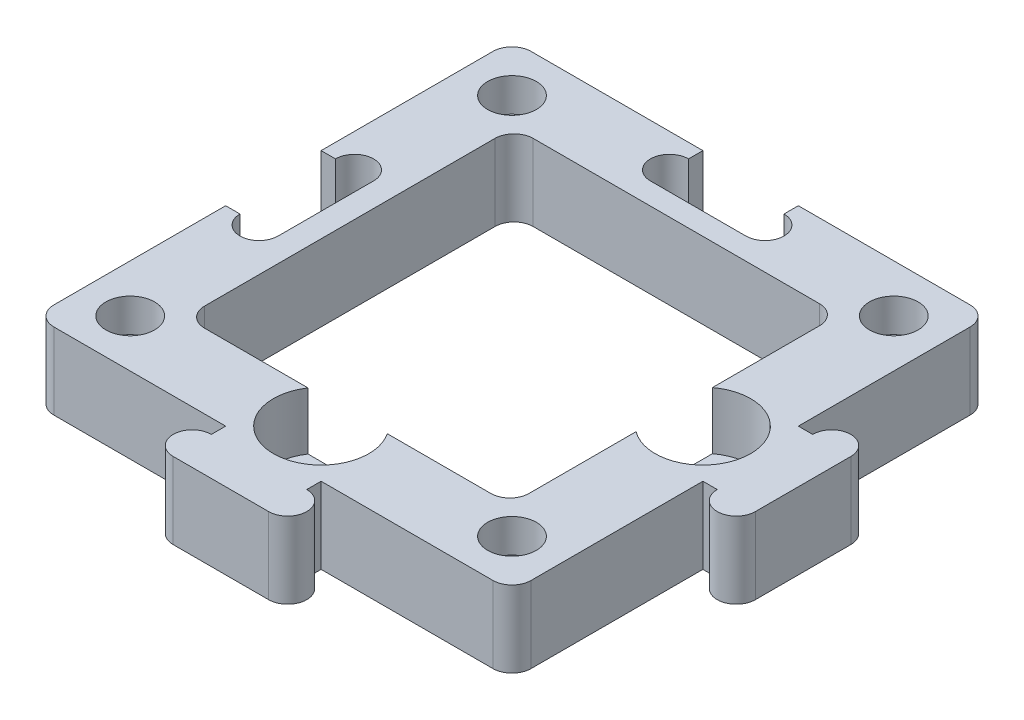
SolidWorks part; units mm, degrees
ref_plane "Front Plane" through (0, 0, 0) normal (0, 0, 1) x (1, 0, 0)
ref_plane "Top Plane" through (0, 0, 0) normal (0, 1, 0) x (1, 0, 0)
ref_plane "Right Plane" through (0, 0, 0) normal (1, 0, 0) x (0, 0, -1)
sketch "Sketch2" plane through (0, 0, 0) normal (0, 1, 0) x (1, 0, 0)
  line L0 (0, -25) -> (0, -20) construction
  line L1 (23, -25) -> (-23, -25)
  line L2 (25, -23) -> (25, 23)
  line L3 (23, 25) -> (5, 25)
  line L4 (-25, -23) -> (-25, -5)
  line L5 (25, -25) -> (-25, 25) construction
  line L6 (25, 25) -> (-25, -25) construction
  line L7 (15, -17.2179) -> (1.25, -17.2179)
  line L8 (17, -15.2179) -> (17, -1.25)
  line L9 (15, 17.2179) -> (-15, 17.2179)
  line L10 (-17, -15.2179) -> (-17, 15.2179)
  line L11 (17, -17.2179) -> (-17, 17.2179) construction
  line L12 (17, 17.2179) -> (-17, -17.2179) construction
  line L13 (25, 0) -> (20, 0) construction
  line L14 (25, 5) -> (26.5, 5)
  line L15 (25, 0) -> (33.3042, 0) construction
  line L16 (25, -5) -> (26.5, -5)
  line L17 (30.5, 5) -> (30.5, -5)
  line L18 (5, -30.5) -> (-5, -30.5)
  line L19 (-5, -25) -> (-5, -26.5)
  line L20 (0, 0) -> (25, -5) construction
  line L21 (0, 0) -> (-5, -25) construction
  line L22 (5, -26.5) -> (5, -25)
  line L23 (0, 25) -> (0, 17.2179) construction
  line L24 (-5, 25) -> (-5, 23.5)
  line L25 (5, 25) -> (5, 23.5)
  line L26 (-5, 19.5) -> (5, 19.5)
  line L27 (-5, 25) -> (-23, 25)
  line L28 (-19.5, -5) -> (-19.5, 5)
  line L29 (-25, 5) -> (-23.5, 5)
  line L30 (-25, -5) -> (-23.5, -5)
  line L31 (-25, 5) -> (-25, 23)
  line L32 (17, 1.25) -> (17, 15.2179)
  line L33 (-1.25, -17.2179) -> (-15, -17.2179)
  arc A0 (23, -25) -> (25, -23) centre (23, -23) ccw
  arc A1 (25, 23) -> (23, 25) centre (23, 23) ccw
  arc A2 (17, 15.2179) -> (15, 17.2179) centre (15, 15.2179) ccw
  arc A3 (15, -17.2179) -> (17, -15.2179) centre (15, -15.2179) ccw
  arc A4 (-15, -17.2179) -> (-17, -15.2179) centre (-15, -15.2179) cw
  arc A5 (-23, -25) -> (-25, -23) centre (-23, -23) cw
  arc A6 (-15, 17.2179) -> (-17, 15.2179) centre (-15, 15.2179) ccw
  arc A7 (-23, 25) -> (-25, 23) centre (-23, 23) ccw
  arc A8 (-1.25, -17.2179) -> (1.25, -17.2179) centre (0, -20) ccw
  arc A9 (17, -1.25) -> (17, 1.25) centre (20, 0) ccw
  arc A10 (26.5, 5) -> (30.5, 5) centre (28.5, 5) cw
  arc A11 (26.5, -5) -> (30.5, -5) centre (28.5, -5) ccw
  arc A12 (-5, -26.5) -> (-5, -30.5) centre (-5, -28.5) ccw
  arc A13 (5, -26.5) -> (5, -30.5) centre (5, -28.5) cw
  arc A14 (-5, 23.5) -> (-5, 19.5) centre (-5, 21.5) ccw
  arc A15 (5, 23.5) -> (5, 19.5) centre (5, 21.5) cw
  arc A16 (-23.5, -5) -> (-19.5, -5) centre (-21.5, -5) ccw
  arc A17 (-23.5, 5) -> (-19.5, 5) centre (-21.5, 5) cw
  circle A18 centre (-20, -20) radius 2.55
  circle A19 centre (-20, 20) radius 2.55
  circle A20 centre (20, 20) radius 2.55
  circle A21 centre (20, -20) radius 2.55
  point P0 (0, 0)
  point P6 (0, 0)
  point P82 (0, 0)
  point P91 (0, 0)
  dimension "D4" = 2
  dimension "D8" = 2
  dimension "D9" = 5.5
  dimension "D14" = 2
  dimension "D20" = 2
  dimension "D25" = 2
  dimension "D26" = 5.1
  dimension "D27" = 5.1
  dimension "D33" = 6.1
  dimension "D34" = 6.5
  dimension "D1" = 50
  dimension "D2" = 50
  dimension "D3" = 34
  dimension "D5" = 5
  dimension "D6" = 5
  dimension "D7" = 10
  dimension "D10" = 2
  dimension "D11" = 90
  dimension "D12" = 1.5
  dimension "D13" = 10
  dimension "D15" = 10
  dimension "D16" = 5
  dimension "D17" = 5
  dimension "D18" = 10
  dimension "D19" = 1.5
  dimension "D22" = 1.5
  dimension "D23" = 20
  dimension "D24" = 10
  dimension "D28" = 5
  dimension "D29" = 4
  dimension "D30" = 5
  dimension "D31" = 5
  dimension "D32" = 5
  dimension "D35" = 13.75
  dimension "D21" = 2
extrude "Boss-Extrude2" add sketch "Sketch2" along normal blind 8 contours L29 A17 L28 A16 L30 L4 A5 L1 A0 L2 A1 L3 L25 A15 L26 A14 L24 L27 A7 L31 A21 A20 A19 A18 A9 L8 A3 L7 A8 L33 A4 L10 A6 L9 A2 L32 | A13 L22 L1 L19 A12 L18 | L16 A11 L17 A10 L14 L2
sketch "Sketch3" plane through (0, 8, 0) normal (0, 1, 0) x (1, 0, 0)
  circle A0 centre (0, -20) radius 5
  circle A1 centre (20, 0) radius 5
  dimension "D1" = 10
extrude "Cut-Extrude1" cut sketch "Sketch3" against normal blind 6
sketch "Sketch5" plane through (0, 0, 0) normal (0, -1, 0) x (1, 0, 0)
  circle A0 centre (-20, 20) radius 3
  circle A1 centre (20, 20) radius 3
  circle A2 centre (20, -20) radius 3
  circle A3 centre (-20, -20) radius 3
  dimension "D1" = 6
extrude "Boss-Extrude3" add sketch "Sketch5" against normal blind 4.5
